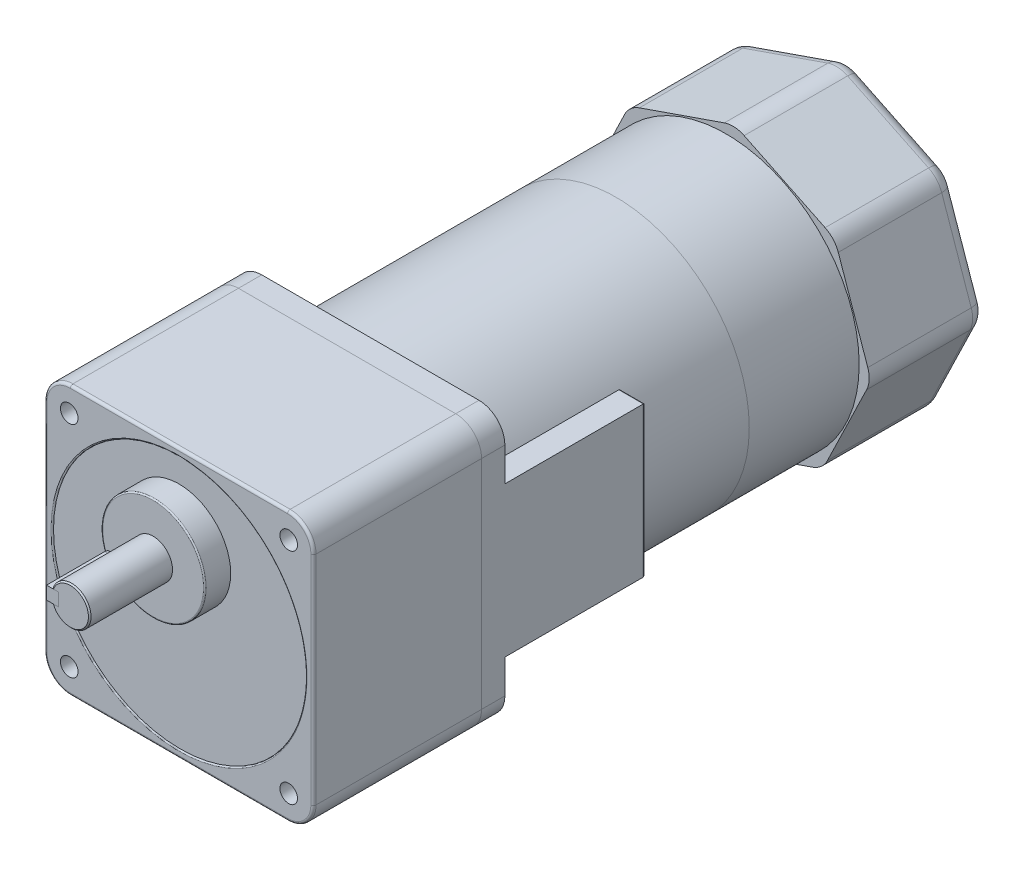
SolidWorks part; units mm, degrees
ref_plane "前视基准面" through (0, 0, 0) normal (0, 0, 1) x (1, 0, 0)
ref_plane "上视基准面" through (0, 0, 0) normal (0, 1, 0) x (1, 0, 0)
ref_plane "右视基准面" through (0, 0, 0) normal (1, 0, 0) x (0, 0, -1)
sketch "草图1" plane through (0, 0, 0) normal (0, 0, 1) x (1, 0, 0)
  line L1 (-42, -52) -> (42, -52)
  line L2 (-52, -42) -> (-52, 42)
  line L3 (-42, 52) -> (42, 52)
  line L4 (52, -42) -> (52, 42)
  line L5 (-52, -52) -> (52, 52) construction
  line L6 (-52, 52) -> (52, -52) construction
  arc A0 (-42, -52) -> (-52, -42) centre (-42, -42) cw
  arc A1 (-52, 42) -> (-42, 52) centre (-42, 42) cw
  arc A2 (42, 52) -> (52, 42) centre (42, 42) cw
  arc A3 (42, -52) -> (52, -42) centre (42, -42) ccw
  point P0 (0, 0)
  dimension "D1" = 10
extrude "凸台-拉伸1" add sketch "草图1" along normal blind 65
sketch "草图2" plane through (0, 0, 0) normal (0, 0, -1) x (-1, 0, 0)
  line L0 (52, 42) -> (52, -42) construction
  line L1 (-42, 52) -> (42, 52)
  line L2 (-52, 42) -> (-52, -42)
  line L3 (-42, -52) -> (42, -52)
  line L4 (52, 42) -> (52, -42)
  line L5 (-52, 52) -> (52, -52) construction
  line L6 (-52, -52) -> (52, 52) construction
  arc A0 (42, -52) -> (52, -42) centre (42, -42) ccw
  arc A1 (-52, -42) -> (-42, -52) centre (-42, -42) ccw
  arc A2 (-42, 52) -> (-52, 42) centre (-42, 42) ccw
  arc A3 (42, 52) -> (52, 42) centre (42, 42) cw
  point P0 (0, 0)
  dimension "D1" = 10
extrude "凸台-拉伸2" add sketch "草图2" along normal blind 9 separate body
sketch "草图3" plane through (0, 0, -9) normal (0, 0, -1) x (-1, 0, 0)
  line L0 (-52, 42) -> (-52, -42) construction
  line L1 (0, 29) -> (-52, 29)
  line L3 (0, -29) -> (-52, -29)
  line L4 (-52, 29) -> (-52, -29)
  line L8 (0, 29) -> (0, -29)
  point P0 (0, 0)
extrude "凸台-拉伸3" add sketch "草图3" along normal blind 54
sketch "草图4" plane through (0, 0, -9) normal (0, 0, -1) x (-1, 0, 0)
  circle A0 centre (0, 0) radius 51.5
extrude "凸台-拉伸4" add sketch "草图4" along normal blind 95 separate body
sketch "草图5" plane through (0, 0, -104) normal (0, 0, -1) x (-1, 0, 0)
  circle A0 centre (0, 0) radius 51.5
extrude "凸台-拉伸5" add sketch "草图5" along normal blind 42.5 separate body
sketch "草图6" plane through (0, 0, -146.5) normal (0, 0, -1) x (-1, 0, 0)
  line L1 (-7.0224, 54.3814) -> (-38.3332, 39.2074)
  line L2 (-43.419, 33.4879) -> (-54.8295, 0.6182)
  line L3 (-54.3814, -7.0224) -> (-39.2074, -38.3332)
  line L4 (-33.4879, -43.419) -> (-0.6182, -54.8295)
  line L5 (7.0224, -54.3814) -> (38.3332, -39.2074)
  line L6 (43.419, -33.4879) -> (54.8295, -0.6182)
  line L7 (54.3814, 7.0224) -> (39.2074, 38.3332)
  line L8 (33.4879, 43.419) -> (0.6182, 54.8295)
  circle A0 centre (0, 0) radius 52 construction
  arc A1 (-54.8295, 0.6182) -> (-54.3814, -7.0224) centre (-45.3825, -2.6612) ccw
  arc A2 (-39.2074, -38.3332) -> (-33.4879, -43.419) centre (-30.2085, -33.9721) ccw
  arc A3 (-0.6182, -54.8295) -> (7.0224, -54.3814) centre (2.6612, -45.3825) ccw
  arc A4 (38.3332, -39.2074) -> (43.419, -33.4879) centre (33.9721, -30.2085) ccw
  arc A5 (54.8295, -0.6182) -> (54.3814, 7.0224) centre (45.3825, 2.6612) ccw
  arc A6 (39.2074, 38.3332) -> (33.4879, 43.419) centre (30.2085, 33.9721) ccw
  arc A7 (-7.0224, 54.3814) -> (0.6182, 54.8295) centre (-2.6612, 45.3825) cw
  arc A8 (-38.3332, 39.2074) -> (-43.419, 33.4879) centre (-33.9721, 30.2085) ccw
  dimension "D1" = 10
extrude "凸台-拉伸6" add sketch "草图6" along normal blind 45 separate body
fillet "圆角1" radius 5 16 edges at (49.1243, 17.0531, -191.5) (41.4449, 36.8535, -191.5) (22.6778, 46.7944, -191.5) (3.2466, 55.3654, -191.5) (-17.0531, 49.1243, -191.5) (-36.8535, 41.4449, -191.5) (-46.7944, 22.6778, -191.5) (-55.3654, 3.2466, -191.5) (-49.1243, -17.0531, -191.5) (-41.4449, -36.8535, -191.5) (-22.6778, -46.7944, -191.5) (-3.2466, -55.3654, -191.5) (17.0531, -49.1243, -191.5) (36.8535, -41.4449, -191.5) (46.7944, -22.6778, -191.5) (55.3654, -3.2466, -191.5)
fillet "圆角2" radius 1 8 edges at (-52, 0, 65) (-49.0711, 49.0711, 65) (0, 52, 65) (49.0711, 49.0711, 65) (52, 0, 65) (49.0711, -49.0711, 65) (0, -52, 65) (-49.0711, -49.0711, 65)
fillet "圆角3" radius 0.5 3 edges at (26, -29, -63) (26, 29, -63) (52, 0, -63)
sketch "草图7" plane through (0, 0, 65) normal (0, 0, 1) x (1, 0, 0)
  point P19 (-42.4264, 42.4264)
  point P20 (-42.4264, -42.4264)
  point P21 (42.4264, -42.4264)
  point P22 (42.4264, 42.4264)
sketch "草图9" plane through (0, 0, -9) normal (0, 0, -1) x (-1, 0, 0)
  circle A5 centre (-42.4264, -42.4264) radius 4.5
  circle A6 centre (42.4264, -42.4264) radius 4.5
  circle A7 centre (-42.4264, 42.4264) radius 4.5
  circle A8 centre (42.4264, 42.4264) radius 4.5
extrude "切除-拉伸1" cut sketch "草图9" against normal blind 51.75
hole_wizard "M8 螺纹孔2" positions "3D草图4" profile "草图11" tap size "M8" standard "GB"
sketch3d "3D草图4"
  point P0 (-42.4264, 42.4264, 65)
  point P3 (42.4264, 42.4264, 65)
  point P6 (42.4264, -42.4264, 65)
  point P9 (-42.4264, -42.4264, 65)
sketch "草图11" plane through (-42.4264, 42.4264, 65) normal (1, 0, 0) x (0, -1, 0)
  line L0 (0, 0) -> (0, 24.2929)
  line L1 (0, 24.2929) -> (3.4, 22.25)
  line L2 (3.4, 22.25) -> (3.4, 0)
  line L5 (3.4, 0) -> (0, 0)
  line L10 (0, 24.2929) -> (-3.4, 22.25) construction
  line L11 (0, -6.35) -> (0, 107.95) construction
  dimension "螺纹孔钻头直径" = 6.8
  dimension "螺纹孔钻头深度" = 22.25
  dimension "导头角度" = 118
sketch "草图12" plane through (0, 0, 65) normal (0, 0, 1) x (1, 0, 0)
  circle A0 centre (0, 20) radius 20
extrude "凸台-拉伸7" add sketch "草图12" along normal blind 10 separate body
fillet "圆角4" radius 0.5 1 edges at (20, 20, 75)
sketch "草图13" plane through (0, 0, 75) normal (0, 0, 1) x (1, 0, 0)
  circle A0 centre (0, 20) radius 7.5
extrude "凸台-拉伸8" add sketch "草图13" along normal blind 32 separate body
ref_plane "基准面1" through (-7.5, 0, 0) normal (1, 0, 0) x (0, 0, -1)
chamfer "倒角2" distance 0.5 angle 45 1 edges at (7.5, 20, 107)
sketch "草图16" plane through (0, 0, 65) normal (0, 0, 1) x (1, 0, 0)
  circle A0 centre (0, 0) radius 49
extrude "切除-拉伸3" cut sketch "草图16" against normal blind 0.5
fillet "圆角5" radius 0.5 1 edges at (49, 0, 65)
sketch "草图19" plane through (-7.5, 0, 0) normal (1, 0, 0) x (0, 0, -1)
  line L1 (-107, 27) -> (-107, 13) construction
  line L2 (-84.5, 22.5) -> (-107, 22.5)
  line L3 (-107, 22.5) -> (-107, 17.5)
  line L4 (-107, 17.5) -> (-84.5, 17.5)
  arc A0 (-84.5, 17.5) -> (-84.5, 22.5) centre (-84.5, 20) ccw
extrude "切除-拉伸4" cut sketch "草图19" along normal blind 3
sketch "草图20" plane through (-4.5, 0, 0) normal (-1, 0, 0) x (0, 0, 1)
  line L0 (84.5, 22.5) -> (107, 22.5)
  line L1 (107, 22.5) -> (107, 17.5)
  line L2 (107, 17.5) -> (84.5, 17.5)
  arc A0 (84.5, 22.5) -> (84.5, 17.5) centre (84.5, 20) ccw
extrude "凸台-拉伸9" add sketch "草图20" along normal blind 5 separate body
chamfer "倒角3" distance 0.3 angle 45 4 edges at (-9.5, 22.5, 95.75) (-9.5, 20, 107) (-9.5, 17.5, 95.75) (-9.5, 20, 82)
